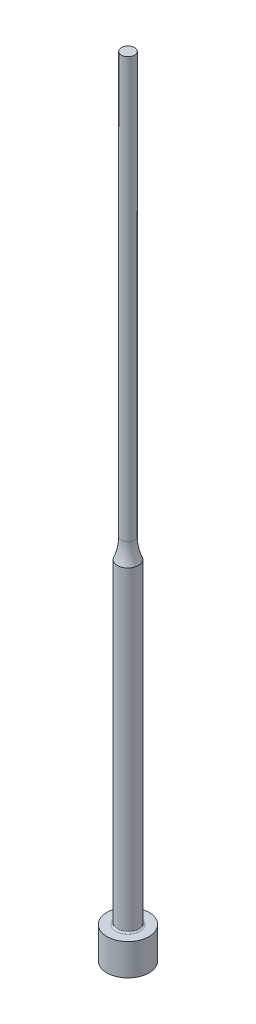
SolidWorks part; units mm, degrees
ref_plane "Front Plane" through (0, 0, 0) normal (0, 0, 1) x (1, 0, 0)
ref_plane "Top Plane" through (0, 0, 0) normal (0, 1, 0) x (1, 0, 0)
ref_plane "Right Plane" through (0, 0, 0) normal (1, 0, 0) x (0, 0, -1)
sketch "Sketch1" plane through (0, 0, 0) normal (0, 0, 1) x (1, 0, 0)
  line L0 (0, 0) -> (4, 0)
  line L1 (55, 0) -> (-55, 0) construction
  line L2 (4, 0) -> (4, 6)
  line L3 (4, 6) -> (2.3, 6)
  line L4 (2, 6.3) -> (2, 66.2003)
  line L6 (1.25, 70) -> (1.25, 150)
  line L7 (1.25, 150) -> (0, 150)
  line L8 (0, 150) -> (0, 0)
  arc A0 (1.25, 70) -> (2, 66.2003) centre (11.25, 70) ccw
  arc A1 (2.3, 6) -> (2, 6.3) centre (2.3, 6.3) cw
  dimension "D7" = 70
  dimension "D8" = 0.3
  dimension "D5" = 10
  dimension "D1" = 1.25
  dimension "D2" = 2
  dimension "D3" = 4
  dimension "D4" = 6
  dimension "D6" = 150
revolve "Revolve1" add sketch "Sketch1" angle 360 about L8
